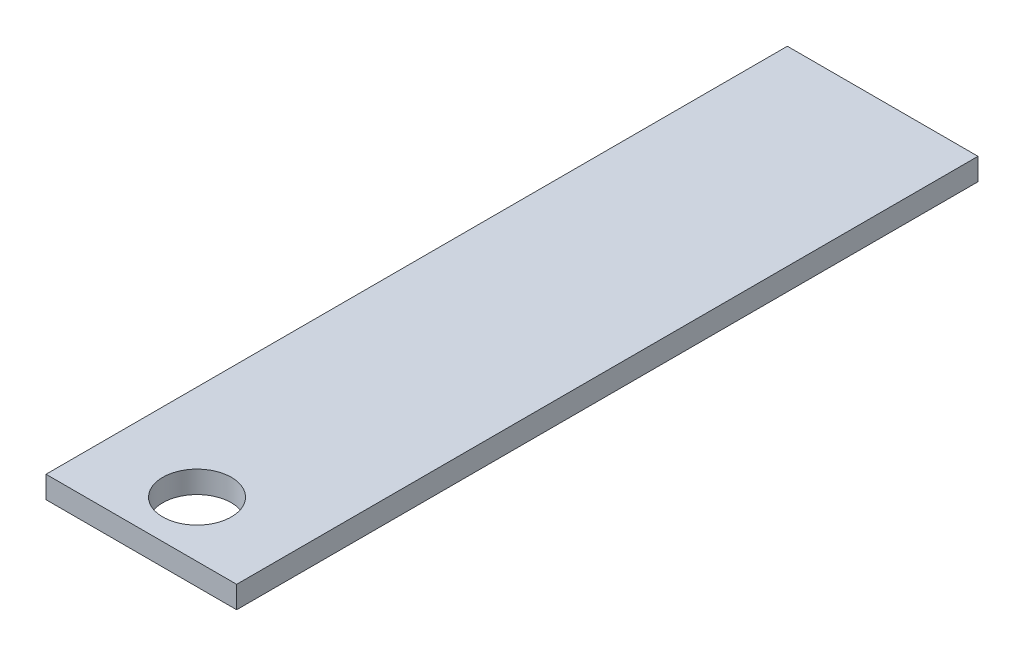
SolidWorks part; units mm, degrees
ref_plane "Front Plane" through (0, 0, 0) normal (0, 0, 1) x (1, 0, 0)
ref_plane "Top Plane" through (0, 0, 0) normal (0, 1, 0) x (1, 0, 0)
ref_plane "Right Plane" through (0, 0, 0) normal (1, 0, 0) x (0, 0, -1)
sketch "Sketch1" plane through (0, 0, 0) normal (0, 0, 1) x (1, 0, 0)
  line L7 (-30.861, -3.5719) -> (30.861, -3.5719)
  line L8 (-30.861, -3.5719) -> (-30.861, 3.5719)
  line L9 (-30.861, 3.5719) -> (30.861, 3.5719)
  line L10 (30.861, -3.5719) -> (30.861, 3.5719)
  line L11 (-30.861, -3.5719) -> (30.861, 3.5719) construction
  line L12 (-30.861, 3.5719) -> (30.861, -3.5719) construction
  point P4 (0, 0)
  point P14 (0, 0)
sketch "Sketch2" plane through (0, 0, 0) normal (0, 1, 0) x (0, 0, -1)
  line L0 (120, 30.861) -> (-120, 30.861) construction
  point P0 (-42.8475, 30.861)
  point P4 (0, 30.861)
  point P6 (42.8475, 30.861)
sketch "Sketch3" plane through (0, 0, 0) normal (0, 0, 1) x (1, 0, 0)
  line L6 (-30.861, 3.5719) -> (30.861, 3.5719)
  line L7 (30.861, 3.5719) -> (30.861, -3.5719)
  line L8 (30.861, -3.5719) -> (-30.861, -3.5719)
  line L9 (-30.861, -3.5719) -> (-30.861, 3.5719)
extrude "Boss-Extrude1" add sketch "Sketch3" along normal mid plane 240
sketch "Sketch5" plane through (0, -3.5719, 0) normal (0, -1, 0) x (1, 0, 0)
  line L0 (0, 120) -> (0, 101.966) construction
  line L1 (-30.861, 120) -> (30.861, 120) construction
  circle A0 centre (0, 101.966) radius 11.1125
  dimension "D2" = 22.225
  dimension "D1" = 18.034
extrude "Cut-Extrude1" cut sketch "Sketch5" against normal up to next
equation "\"D1@Boss-Extrude1\" = \"Length@Sketch2\""
equation "\"D1@Sketch2\"=\"Width@Sketch1\" * 1.25"
equation "\"D2@Sketch2\"=\"D1@Sketch2\""
